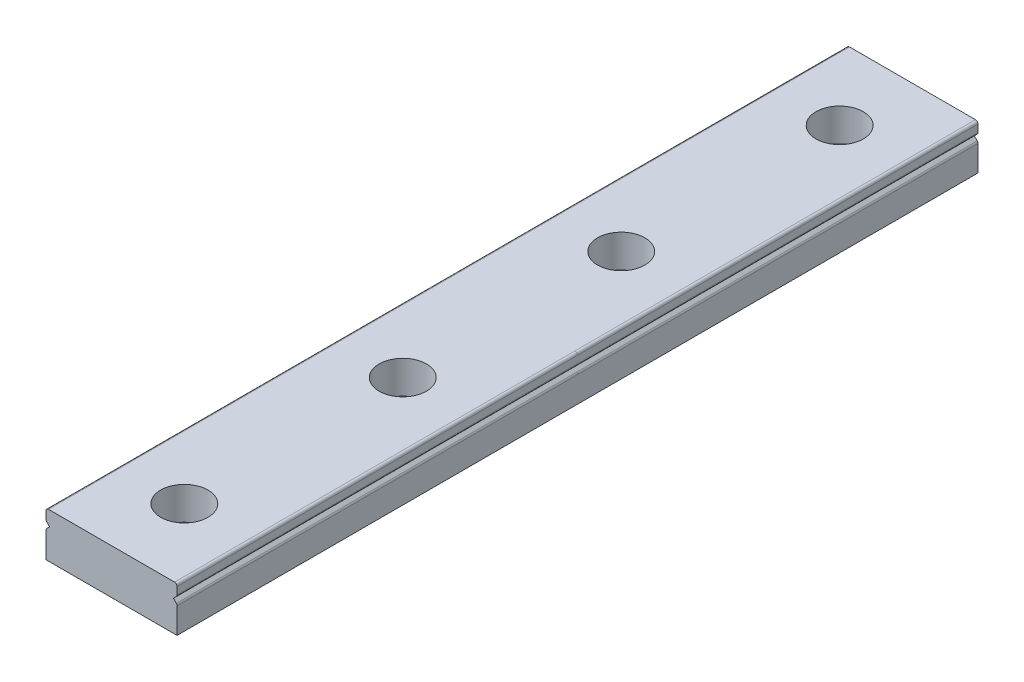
SolidWorks part; units mm, degrees
ref_plane "Front" through (0, 0, 0) normal (0, 0, 1) x (1, 0, 0)
ref_plane "Top" through (0, 0, 0) normal (0, 1, 0) x (1, 0, 0)
ref_plane "Right" through (0, 0, 0) normal (1, 0, 0) x (0, 0, -1)
sketch "Sketch2" plane through (0, 0, 0) normal (0, 0, 1) x (1, 0, 0)
  line L0 (8.5, 5) -> (9, 4.5)
  line L1 (0, 7) -> (9, 7)
  line L2 (0, 7) -> (0, 0.8302)
  line L3 (0, 0.8302) -> (9, 0.8302)
  line L4 (9, 0.8302) -> (9, 4.5)
  line L5 (9, 7) -> (9, 5.5)
  line L6 (9, 5.5) -> (8.5, 5)
  dimension "D1" = 7
  dimension "D2" = 9
  dimension "D3" = 1
  dimension "D4" = 1.5
extrude "Extrude3" add sketch "Sketch2" along normal blind 55
fillet "Fillet1" radius 0.35 3 edges at (9, 7, 27.5) (9, 5.5, 27.5) (9, 4.5, 27.5)
mirror "Mirror1" about plane through (0, 0, 0) normal (1, 0, 0) of "Fillet1", "Extrude3"
hole_wizard "CBORE for M3 SBHCS1" positions "Sketch4" profile "Sketch3" counterbore size "M3" standard "Ansi Metric"
sketch "Sketch4" plane through (0, 7, 0) normal (0, 1, 0) x (-1, 0, 0)
  point P0 (0, 15)
  dimension "D1" = 15
sketch "Sketch3" plane through (0, 7, 15) normal (1, 0, 0) x (0, 0, 1)
  line L0 (0, 0) -> (0, 6.1698)
  line L1 (0, 6.1698) -> (1.75, 6.1698)
  line L3 (1.75, 6.1698) -> (1.75, 4.5)
  line L4 (1.75, 4.5) -> (3.25, 4.5)
  line L5 (3.25, 4.5) -> (3.25, 0)
  line L7 (3.25, 0) -> (0, 0)
  line L11 (0, -6.35) -> (0, 107.95) construction
  dimension "Thru Hole Dia." = 3.5
  dimension "Thru Hole Depth" = 6.1698
  dimension "C'Bore Dia." = 6.5
  dimension "C'Bore Depth" = 4.5
pattern_linear "LPattern3" count 2 spacing 30 along (0, 0, 1) of "CBORE for M3 SBHCS1"
mirror "Mirror2" about plane through (0, 0, 0) normal (0, 0, 1) of "LPattern3", "CBORE for M3 SBHCS1", "Mirror1", "Fillet1", "Extrude3"
sketch "Sketch5" plane through (0, 0, 0) normal (0, 1, 0) x (1, 0, 0)
  line L1 (-20.5415, 52.85) -> (20.5416, 52.85)
  line L2 (-20.5415, 52.85) -> (-20.5415, -52.85)
  line L3 (-20.5415, -52.85) -> (20.5416, -52.85)
  line L4 (20.5416, 52.85) -> (20.5416, -52.85)
  point P4 (20.5416, 0)
  dimension "D1" = 105.7
extrude "Cut-Extrude2" [suppressed] cut sketch "Sketch5" along normal through all flip side to cut
